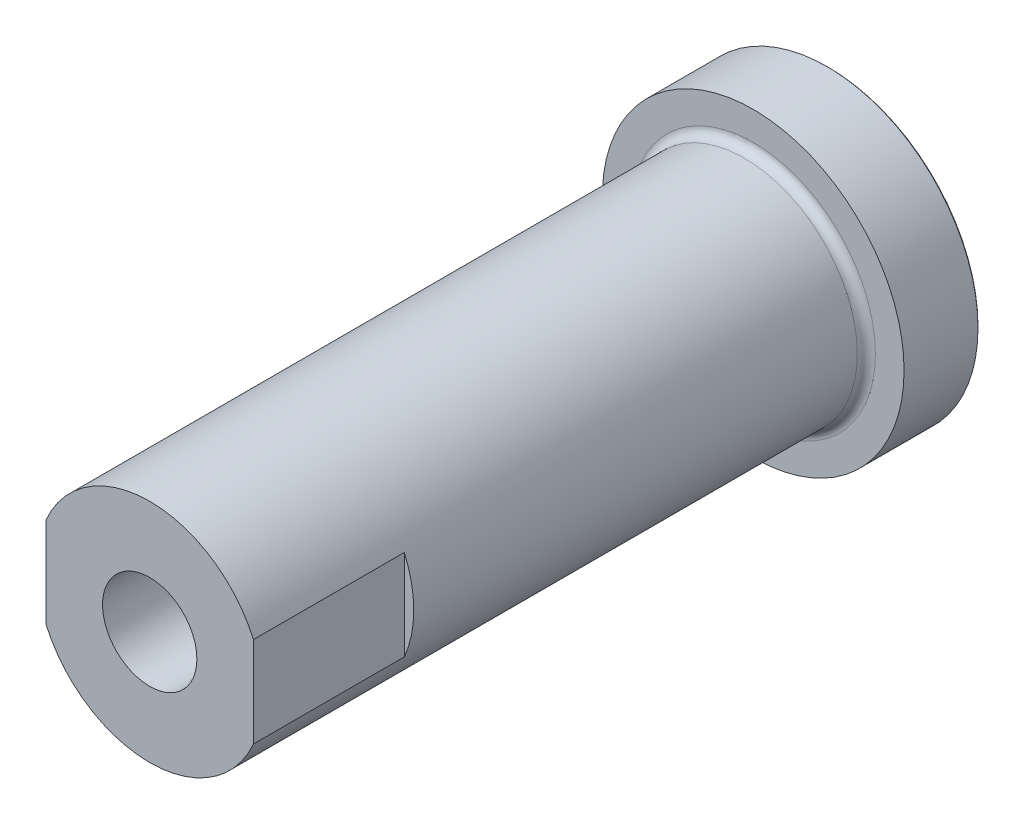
SolidWorks part; units mm, degrees
ref_plane "Front" through (0, 0, 0) normal (0, 0, 1) x (1, 0, 0)
ref_plane "Top" through (0, 0, 0) normal (0, 1, 0) x (1, 0, 0)
ref_plane "Right" through (0, 0, 0) normal (1, 0, 0) x (0, 0, -1)
sketch "Logo3_Revol_Axis" plane through (0, 0, 0) normal (0, 1, 0) x (1, 0, 0)
  line L0 (0, -43.5172) -> (0, 43.5172) construction
sketch "Logo3_bib1" plane through (0, 0, 0) normal (0, 1, 0) x (1, 0, 0)
  line L0 (0, 22.1351) -> (0, 57.15)
  line L2 (3.9687, 0) -> (3.9687, 19.8437)
  line L3 (0, 57.15) -> (12.573, 57.15)
  line L4 (12.7, 57.023) -> (12.7, 50.8)
  line L5 (12.7, 50.8) -> (10.287, 50.8)
  line L6 (9.525, 50.038) -> (9.525, 0)
  line L7 (9.525, 0) -> (3.9687, 0)
  line L8 (0, -43.5172) -> (0, 43.5172) construction
  line L9 (0, -6.5134) -> (0, 53.6885) construction
  line L10 (12.573, 57.15) -> (12.7, 57.023)
  line L11 (3.9687, 19.8437) -> (0, 22.1351)
  line L12 (-3.9687, 19.8437) -> (0, 22.1351) construction
  line L13 (9.525, 0) -> (9.525, 18.7703) construction
  arc A0 (10.287, 50.8) -> (9.525, 50.038) centre (10.287, 50.038) ccw
  dimension "Logo3_radius" = 0.762
  dimension "D1" = 45
  dimension "Logo3_dt1" = 19.05
  dimension "Logo3_lt1" = 50.8
  dimension "Logo3_h2" = 6.35
  dimension "Logo3_dr2" = 25.4
  dimension "Logo3_h2/50" = 0.127
  dimension "A1" = 120
  dimension "Logo3_dm-pas" = 7.9375
  dimension "Logo3_lm+0.5*pas" = 19.8437
  dimension "Logo3_dm" = 9.525
revolve "Revolve1" add sketch "Logo3_bib1" angle 360 about L9
sketch "Logo3_bib4" plane through (0, 0, 0) normal (0, 1, 0) x (1, 0, 0)
  line L0 (0, 0) -> (0, -13.7555) construction
  line L1 (12.7, 0) -> (8.7312, 0)
  line L2 (12.7, 0) -> (12.7, 12.7)
  line L3 (12.7, 12.7) -> (8.7312, 12.7)
  line L4 (8.7312, 0) -> (8.7312, 12.7)
  line L5 (-12.7, 0) -> (-8.7312, 0)
  line L6 (-8.7312, 0) -> (-8.7313, 12.7)
  line L7 (-12.7, 12.7) -> (-8.7313, 12.7)
  line L8 (-12.7, 0) -> (-12.7, 12.7)
  dimension "Logo3_d_flat" = 17.4625
  dimension "Logo3_dr2" = 25.4
  dimension "Logo3_h_flat" = 12.7
extrude "Cut-Extrude2" cut sketch "Logo3_bib4" against normal mid plane 38.1
